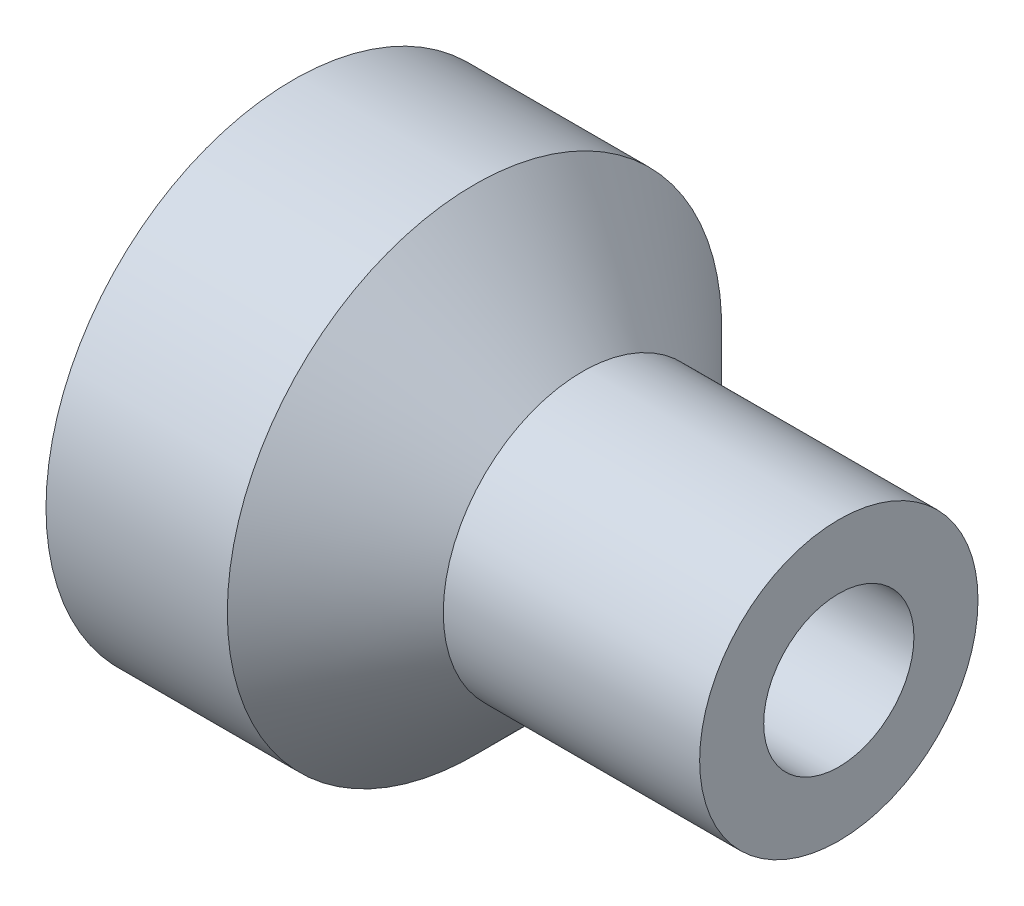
SolidWorks part; units mm, degrees
ref_plane "Front Plane" through (0, 0, 0) normal (0, 0, 1) x (1, 0, 0)
ref_plane "Top Plane" through (0, 0, 0) normal (0, 1, 0) x (1, 0, 0)
ref_plane "Right Plane" through (0, 0, 0) normal (1, 0, 0) x (0, 0, -1)
sketch "Sketch1" plane through (0, 0, 0) normal (1, 0, 0) x (0, 0, -1)
  circle A0 centre (0, 0) radius 4.03
  circle A1 centre (0, 0) radius 2.175
  dimension "D1" = 8.06
  dimension "D2" = 4.35
extrude "Boss-Extrude1" add sketch "Sketch1" along normal blind 15.8
sketch "Sketch2" plane through (0, 0, 0) normal (-1, 0, 0) x (0, 0, 1)
  circle A0 centre (0, 0) radius 7.1567
  circle A1 centre (0, 0) radius 2.175
extrude "Boss-Extrude2" add sketch "Sketch2" against normal blind 8.8
chamfer "Chamfer1" distance 3.55 angle 45 1 edges at (8.8, 0, 7.1567)
sketch "Sketch3" plane through (0, 0, 0) normal (-1, 0, 0) x (0, 0, 1)
  circle A0 centre (0, 0) radius 3.075
  dimension "D1" = 6.15
extrude "Cut-Extrude1" cut sketch "Sketch3" against normal blind 8
chamfer "Chamfer2" distance 1 angle 45 1 edges at (8, 0, 2.175)
